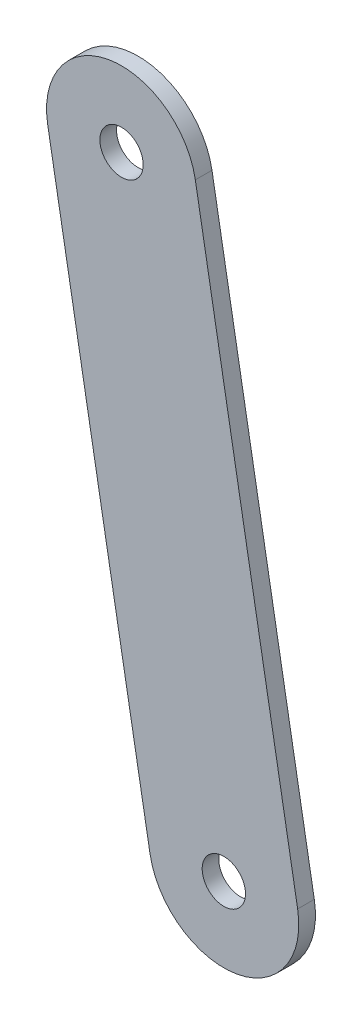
SolidWorks part; units mm, degrees
ref_plane "Alzado" through (0, 0, 0) normal (0, 0, 1) x (1, 0, 0)
ref_plane "Planta" through (0, 0, 0) normal (0, 1, 0) x (1, 0, 0)
ref_plane "Vista lateral" through (0, 0, 0) normal (1, 0, 0) x (0, 0, -1)
ref_plane "Plano2" through (0, 0, -4.4) normal (0, 0, 1) x (1, 0, 0)
sketch "Sk_Placa_jaula_interior" plane through (0, 0, -4.4) normal (0, 0, 1) x (1, 0, 0)
  line L0 (-30.8633, -69.5628) -> (-18.5777, -139.238)
  line L1 (-0.8511, -136.1123) -> (-13.1367, -66.4372)
  arc A0 (-18.5777, -139.238) -> (-0.8511, -136.1123) centre (-9.7144, -137.6751) ccw
  arc A1 (-13.1367, -66.4372) -> (-30.8633, -69.5628) centre (-22, -68) ccw
  circle A2 centre (-22, -68) radius 2.6
  circle A3 centre (-9.7144, -137.6751) radius 2.6
extrude "Placa_jaula_interior" add sketch "Sk_Placa_jaula_interior" along normal blind 2
